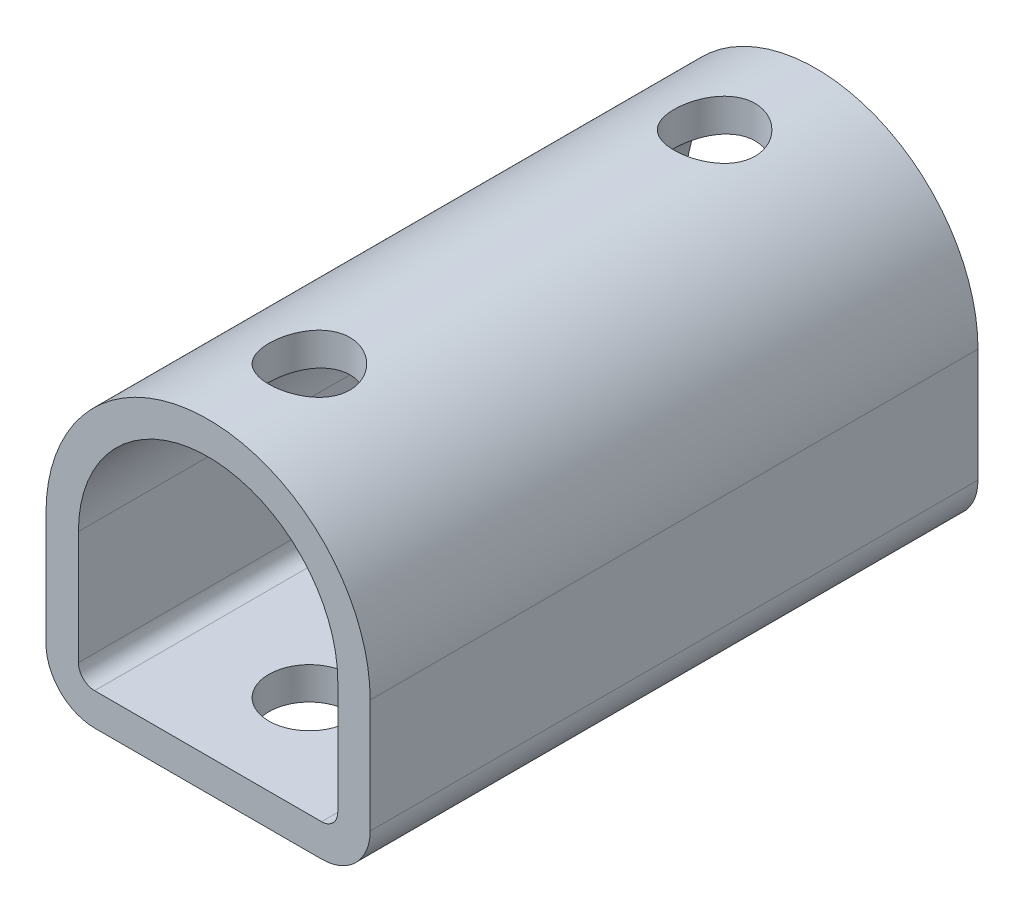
SolidWorks part; units mm, degrees
ref_plane "Front Plane" through (0, 0, 0) normal (0, 0, 1) x (1, 0, 0)
ref_plane "Top Plane" through (0, 0, 0) normal (0, 1, 0) x (1, 0, 0)
ref_plane "Right Plane" through (0, 0, 0) normal (1, 0, 0) x (0, 0, -1)
sketch "Sketch1" plane through (0, 0, 0) normal (0, 0, 1) x (1, 0, 0)
  line L0 (-20, 0) -> (-20, -14)
  line L1 (-14, -20) -> (14, -20)
  line L2 (20, -14) -> (20, 0)
  line L3 (-16, 0) -> (-16, -14)
  line L4 (-14, -16) -> (14, -16)
  line L5 (16, -14) -> (16, 0)
  arc A0 (20, 0) -> (-20, 0) centre (0, 0) ccw
  arc A1 (14, -20) -> (20, -14) centre (14, -14) ccw
  arc A2 (-20, -14) -> (-14, -20) centre (-14, -14) ccw
  arc A3 (16, 0) -> (-16, 0) centre (0, 0) ccw
  arc A4 (-16, -14) -> (-14, -16) centre (-14, -14) ccw
  arc A5 (14, -16) -> (16, -14) centre (14, -14) ccw
  dimension "D1" = 40
  dimension "D3" = 6
  dimension "D2" = 20
  dimension "D4" = 4
extrude "Boss-Extrude2" add sketch "Sketch1" along normal mid plane 75
hole_wizard "Ø10.0 (10) Diameter Hole1" positions "Sketch3" profile "Sketch2" hole size "Ø10.0" standard "ANSI Metric"
sketch "Sketch3" plane through (0, -20, 0) normal (0, -1, 0) x (-1, 0, 0)
  line L0 (0, 0) -> (31.8685, 0) construction
  point P0 (0, 25)
  point P2 (0, -25)
  dimension "D1" = 50
sketch "Sketch2" plane through (0, -20, -25) normal (1, 0, 0) x (0, 0, -1)
  line L0 (0, 0) -> (0, 40)
  line L1 (0, 40) -> (5, 40)
  line L2 (5, 40) -> (5, 0)
  line L5 (5, 0) -> (0, 0)
  line L11 (0, -6.35) -> (0, 107.95) construction
  dimension "Thru Hole Dia." = 10
  dimension "Thru Hole Depth" = 40
